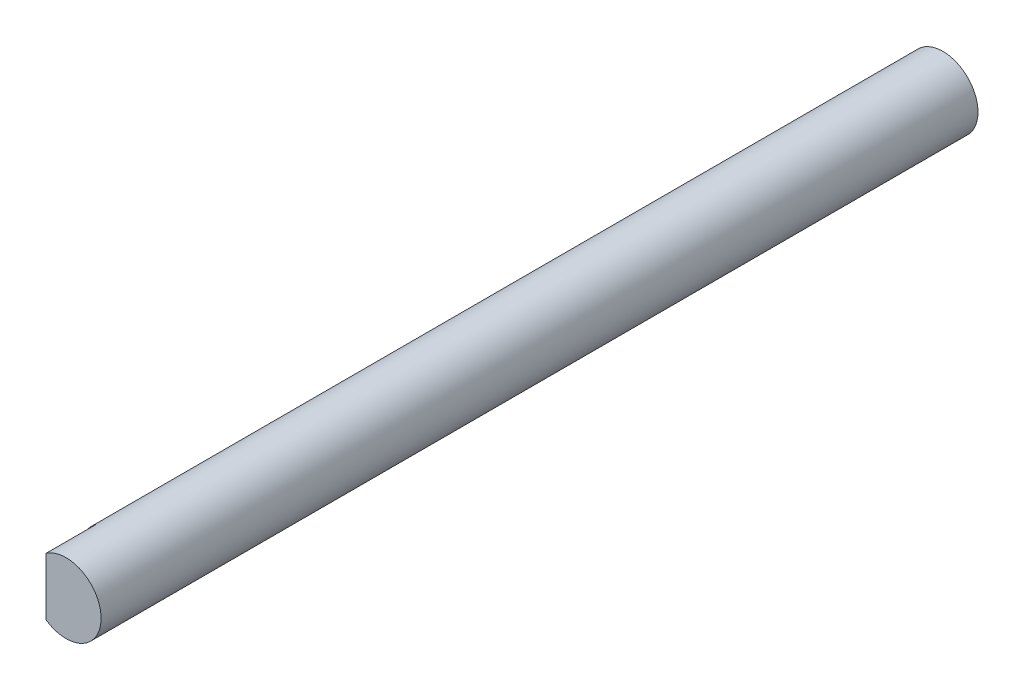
SolidWorks part; units mm, degrees
ref_plane "Front" through (0, 0, 0) normal (0, 0, 1) x (1, 0, 0)
ref_plane "Top" through (0, 0, 0) normal (0, 1, 0) x (1, 0, 0)
ref_plane "Right" through (0, 0, 0) normal (1, 0, 0) x (0, 0, -1)
sketch "Sketch1" plane through (0, 0, 0) normal (0, 0, 1) x (1, 0, 0)
  circle A0 centre (0, 0) radius 7
  dimension "D1" = 14
extrude "Extrude1" add sketch "Sketch1" along normal blind 175
sketch "Sketch2" plane through (0, 0, 175) normal (0, 0, 1) x (1, 0, 0)
  line L1 (-4, -17.2853) -> (-7, -17.2853)
  line L2 (-4, -17.2853) -> (-4, 10.814)
  line L3 (-4, 10.814) -> (-7, 10.814)
  line L4 (-7, -17.2853) -> (-7, 10.814)
  circle A0 centre (0, 0) radius 7 construction
  dimension "D1" = 3
extrude "Cut-Extrude1" cut sketch "Sketch2" against normal blind 10
